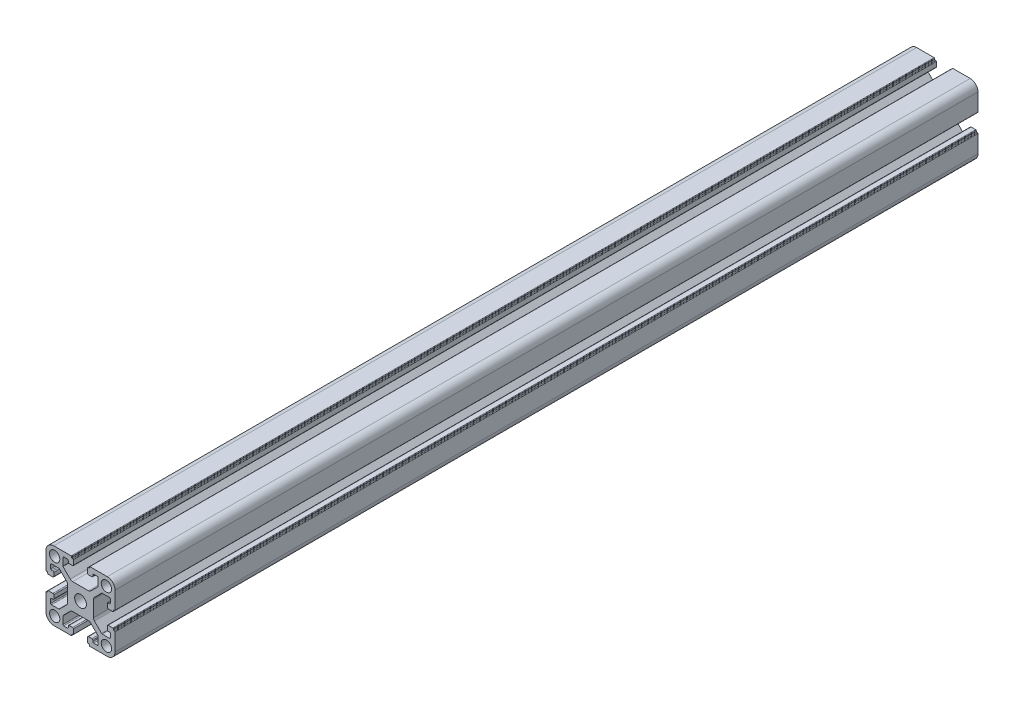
SolidWorks part; units mm, degrees
ref_plane "前视基准面" through (0, 0, 0) normal (0, 0, 1) x (1, 0, 0)
ref_plane "上视基准面" through (0, 0, 0) normal (0, 1, 0) x (1, 0, 0)
ref_plane "右视基准面" through (0, 0, 0) normal (1, 0, 0) x (0, 0, -1)
sketch "Model" plane through (0, 0, 0) normal (0, 0, 1) x (1, 0, 0)
  line L0 (2122.4889, 1192.84) -> (2122.4889, 1192.44)
  line L1 (2122.7889, 1192.14) -> (2123.1889, 1192.14)
  line L2 (2123.4889, 1191.84) -> (2123.4889, 1181.74)
  line L3 (2118.9889, 1177.24) -> (2108.8889, 1177.24)
  line L4 (2108.5889, 1177.54) -> (2108.5889, 1177.94)
  line L5 (2108.2889, 1178.24) -> (2107.8889, 1178.24)
  line L6 (2107.5889, 1178.54) -> (2107.5889, 1181.24)
  line L7 (2108.0889, 1181.74) -> (2110.0889, 1181.74)
  line L8 (2110.5889, 1181.24) -> (2110.5889, 1180.44)
  line L9 (2111.0889, 1179.94) -> (2113.2389, 1179.94)
  line L10 (2113.7389, 1180.44) -> (2113.7389, 1184.6616)
  line L11 (2113.5925, 1185.0151) -> (2109.4534, 1189.1542)
  line L12 (2108.0392, 1189.74) -> (2098.9387, 1189.74)
  line L13 (2097.5245, 1189.1542) -> (2093.3854, 1185.0151)
  line L14 (2093.2389, 1184.6616) -> (2093.2389, 1180.44)
  line L15 (2093.7389, 1179.94) -> (2095.8889, 1179.94)
  line L16 (2096.3889, 1180.44) -> (2096.3889, 1181.24)
  line L17 (2096.8889, 1181.74) -> (2098.8889, 1181.74)
  line L18 (2099.3889, 1181.24) -> (2099.3889, 1178.54)
  line L19 (2099.0889, 1178.24) -> (2098.6889, 1178.24)
  line L20 (2098.3889, 1177.94) -> (2098.3889, 1177.54)
  line L21 (2098.0889, 1177.24) -> (2087.9889, 1177.24)
  line L22 (2083.4889, 1181.74) -> (2083.4889, 1191.84)
  line L23 (2083.7889, 1192.14) -> (2084.1889, 1192.14)
  line L24 (2084.4889, 1192.44) -> (2084.4889, 1192.84)
  line L25 (2084.7889, 1193.14) -> (2087.4889, 1193.14)
  line L26 (2087.9889, 1192.64) -> (2087.9889, 1190.64)
  line L27 (2087.4889, 1190.14) -> (2086.6889, 1190.14)
  line L28 (2086.1889, 1189.64) -> (2086.1889, 1187.49)
  line L29 (2086.6889, 1186.99) -> (2090.9105, 1186.99)
  line L30 (2091.2641, 1187.1365) -> (2095.4031, 1191.2756)
  line L31 (2095.9889, 1192.6898) -> (2095.9889, 1201.7903)
  line L32 (2095.4031, 1203.2045) -> (2091.2641, 1207.3436)
  line L33 (2090.9105, 1207.49) -> (2086.6889, 1207.49)
  line L34 (2086.1889, 1206.99) -> (2086.1889, 1204.84)
  line L35 (2086.6889, 1204.34) -> (2087.4889, 1204.34)
  line L36 (2087.9889, 1203.84) -> (2087.9889, 1201.84)
  line L37 (2087.4889, 1201.34) -> (2084.7889, 1201.34)
  line L38 (2084.4889, 1201.64) -> (2084.4889, 1202.04)
  line L39 (2084.1889, 1202.34) -> (2083.7889, 1202.34)
  line L40 (2083.4889, 1202.64) -> (2083.4889, 1212.74)
  line L41 (2087.9889, 1217.24) -> (2098.0889, 1217.24)
  line L42 (2098.3889, 1216.94) -> (2098.3889, 1216.54)
  line L43 (2098.6889, 1216.24) -> (2099.0889, 1216.24)
  line L44 (2099.3889, 1215.94) -> (2099.3889, 1213.24)
  line L45 (2098.8889, 1212.74) -> (2096.8889, 1212.74)
  line L46 (2096.3889, 1213.24) -> (2096.3889, 1214.04)
  line L47 (2095.8889, 1214.54) -> (2093.7389, 1214.54)
  line L48 (2093.2389, 1214.04) -> (2093.2389, 1209.8184)
  line L49 (2093.3854, 1209.4649) -> (2097.5245, 1205.3258)
  line L50 (2098.9387, 1204.74) -> (2108.0392, 1204.74)
  line L51 (2109.4534, 1205.3258) -> (2113.5925, 1209.4649)
  line L52 (2113.7389, 1209.8184) -> (2113.7389, 1214.04)
  line L53 (2113.2389, 1214.54) -> (2111.0889, 1214.54)
  line L54 (2110.5889, 1214.04) -> (2110.5889, 1213.24)
  line L55 (2110.0889, 1212.74) -> (2108.0889, 1212.74)
  line L56 (2107.5889, 1213.24) -> (2107.5889, 1215.94)
  line L57 (2107.8889, 1216.24) -> (2108.2889, 1216.24)
  line L58 (2108.5889, 1216.54) -> (2108.5889, 1216.94)
  line L59 (2108.8889, 1217.24) -> (2118.9889, 1217.24)
  line L60 (2123.4889, 1212.74) -> (2123.4889, 1202.64)
  line L61 (2123.1889, 1202.34) -> (2122.7889, 1202.34)
  line L62 (2122.4889, 1202.04) -> (2122.4889, 1201.64)
  line L63 (2122.1889, 1201.34) -> (2119.4889, 1201.34)
  line L64 (2118.9889, 1201.84) -> (2118.9889, 1203.84)
  line L65 (2119.4889, 1204.34) -> (2120.2889, 1204.34)
  line L66 (2120.7889, 1204.84) -> (2120.7889, 1206.99)
  line L67 (2120.2889, 1207.49) -> (2116.0674, 1207.49)
  line L68 (2115.7138, 1207.3436) -> (2111.5747, 1203.2045)
  line L69 (2110.9889, 1201.7903) -> (2110.9889, 1192.6898)
  line L70 (2111.5747, 1191.2756) -> (2115.7138, 1187.1365)
  line L71 (2116.0674, 1186.99) -> (2120.2889, 1186.99)
  line L72 (2120.7889, 1187.49) -> (2120.7889, 1189.64)
  line L73 (2120.2889, 1190.14) -> (2119.4889, 1190.14)
  line L74 (2118.9889, 1190.64) -> (2118.9889, 1192.64)
  line L75 (2119.4889, 1193.14) -> (2122.1889, 1193.14)
  circle A1 centre (2103.4889, 1197.24) radius 3.4
  circle A2 centre (2118.4889, 1212.24) radius 3
  circle A3 centre (2088.4889, 1212.24) radius 3
  circle A4 centre (2088.4889, 1182.24) radius 3
  circle A5 centre (2118.4889, 1182.24) radius 3
  arc A6 (2122.4889, 1192.44) -> (2122.7889, 1192.14) centre (2122.7889, 1192.44) ccw
  arc A7 (2123.4889, 1191.84) -> (2123.1889, 1192.14) centre (2123.1889, 1191.84) ccw
  arc A8 (2118.9889, 1177.24) -> (2123.4889, 1181.74) centre (2118.9889, 1181.74) ccw
  arc A9 (2108.5889, 1177.54) -> (2108.8889, 1177.24) centre (2108.8889, 1177.54) ccw
  arc A10 (2108.5889, 1177.94) -> (2108.2889, 1178.24) centre (2108.2889, 1177.94) ccw
  arc A11 (2107.5889, 1178.54) -> (2107.8889, 1178.24) centre (2107.8889, 1178.54) ccw
  arc A12 (2108.0889, 1181.74) -> (2107.5889, 1181.24) centre (2108.0889, 1181.24) ccw
  arc A13 (2110.5889, 1181.24) -> (2110.0889, 1181.74) centre (2110.0889, 1181.24) ccw
  arc A14 (2110.5889, 1180.44) -> (2111.0889, 1179.94) centre (2111.0889, 1180.44) ccw
  arc A15 (2113.2389, 1179.94) -> (2113.7389, 1180.44) centre (2113.2389, 1180.44) ccw
  arc A16 (2113.7389, 1184.6616) -> (2113.5925, 1185.0151) centre (2113.2389, 1184.6616) ccw
  arc A17 (2109.4534, 1189.1542) -> (2108.0392, 1189.74) centre (2108.0392, 1187.74) ccw
  arc A18 (2098.9387, 1189.74) -> (2097.5245, 1189.1542) centre (2098.9387, 1187.74) ccw
  arc A19 (2093.3854, 1185.0151) -> (2093.2389, 1184.6616) centre (2093.7389, 1184.6616) ccw
  arc A20 (2093.2389, 1180.44) -> (2093.7389, 1179.94) centre (2093.7389, 1180.44) ccw
  arc A21 (2095.8889, 1179.94) -> (2096.3889, 1180.44) centre (2095.8889, 1180.44) ccw
  arc A22 (2096.8889, 1181.74) -> (2096.3889, 1181.24) centre (2096.8889, 1181.24) ccw
  arc A23 (2099.3889, 1181.24) -> (2098.8889, 1181.74) centre (2098.8889, 1181.24) ccw
  arc A24 (2099.0889, 1178.24) -> (2099.3889, 1178.54) centre (2099.0889, 1178.54) ccw
  arc A25 (2098.6889, 1178.24) -> (2098.3889, 1177.94) centre (2098.6889, 1177.94) ccw
  arc A26 (2098.0889, 1177.24) -> (2098.3889, 1177.54) centre (2098.0889, 1177.54) ccw
  arc A27 (2083.4889, 1181.74) -> (2087.9889, 1177.24) centre (2087.9889, 1181.74) ccw
  arc A28 (2083.7889, 1192.14) -> (2083.4889, 1191.84) centre (2083.7889, 1191.84) ccw
  arc A29 (2084.1889, 1192.14) -> (2084.4889, 1192.44) centre (2084.1889, 1192.44) ccw
  arc A30 (2084.7889, 1193.14) -> (2084.4889, 1192.84) centre (2084.7889, 1192.84) ccw
  arc A31 (2087.9889, 1192.64) -> (2087.4889, 1193.14) centre (2087.4889, 1192.64) ccw
  arc A32 (2087.4889, 1190.14) -> (2087.9889, 1190.64) centre (2087.4889, 1190.64) ccw
  arc A33 (2086.6889, 1190.14) -> (2086.1889, 1189.64) centre (2086.6889, 1189.64) ccw
  arc A34 (2086.1889, 1187.49) -> (2086.6889, 1186.99) centre (2086.6889, 1187.49) ccw
  arc A35 (2090.9105, 1186.99) -> (2091.2641, 1187.1365) centre (2090.9105, 1187.49) ccw
  arc A36 (2095.4031, 1191.2756) -> (2095.9889, 1192.6898) centre (2093.9889, 1192.6898) ccw
  arc A37 (2095.9889, 1201.7903) -> (2095.4031, 1203.2045) centre (2093.9889, 1201.7903) ccw
  arc A38 (2091.2641, 1207.3436) -> (2090.9105, 1207.49) centre (2090.9105, 1206.99) ccw
  arc A39 (2086.6889, 1207.49) -> (2086.1889, 1206.99) centre (2086.6889, 1206.99) ccw
  arc A40 (2086.1889, 1204.84) -> (2086.6889, 1204.34) centre (2086.6889, 1204.84) ccw
  arc A41 (2087.9889, 1203.84) -> (2087.4889, 1204.34) centre (2087.4889, 1203.84) ccw
  arc A42 (2087.4889, 1201.34) -> (2087.9889, 1201.84) centre (2087.4889, 1201.84) ccw
  arc A43 (2084.4889, 1201.64) -> (2084.7889, 1201.34) centre (2084.7889, 1201.64) ccw
  arc A44 (2084.4889, 1202.04) -> (2084.1889, 1202.34) centre (2084.1889, 1202.04) ccw
  arc A45 (2083.4889, 1202.64) -> (2083.7889, 1202.34) centre (2083.7889, 1202.64) ccw
  arc A46 (2087.9889, 1217.24) -> (2083.4889, 1212.74) centre (2087.9889, 1212.74) ccw
  arc A47 (2098.3889, 1216.94) -> (2098.0889, 1217.24) centre (2098.0889, 1216.94) ccw
  arc A48 (2098.3889, 1216.54) -> (2098.6889, 1216.24) centre (2098.6889, 1216.54) ccw
  arc A49 (2099.3889, 1215.94) -> (2099.0889, 1216.24) centre (2099.0889, 1215.94) ccw
  arc A50 (2098.8889, 1212.74) -> (2099.3889, 1213.24) centre (2098.8889, 1213.24) ccw
  arc A51 (2096.3889, 1213.24) -> (2096.8889, 1212.74) centre (2096.8889, 1213.24) ccw
  arc A52 (2096.3889, 1214.04) -> (2095.8889, 1214.54) centre (2095.8889, 1214.04) ccw
  arc A53 (2093.7389, 1214.54) -> (2093.2389, 1214.04) centre (2093.7389, 1214.04) ccw
  arc A54 (2093.2389, 1209.8184) -> (2093.3854, 1209.4649) centre (2093.7389, 1209.8184) ccw
  arc A55 (2097.5245, 1205.3258) -> (2098.9387, 1204.74) centre (2098.9387, 1206.74) ccw
  arc A56 (2108.0392, 1204.74) -> (2109.4534, 1205.3258) centre (2108.0392, 1206.74) ccw
  arc A57 (2113.5925, 1209.4649) -> (2113.7389, 1209.8184) centre (2113.2389, 1209.8184) ccw
  arc A58 (2113.7389, 1214.04) -> (2113.2389, 1214.54) centre (2113.2389, 1214.04) ccw
  arc A59 (2111.0889, 1214.54) -> (2110.5889, 1214.04) centre (2111.0889, 1214.04) ccw
  arc A60 (2110.0889, 1212.74) -> (2110.5889, 1213.24) centre (2110.0889, 1213.24) ccw
  arc A61 (2107.5889, 1213.24) -> (2108.0889, 1212.74) centre (2108.0889, 1213.24) ccw
  arc A62 (2107.8889, 1216.24) -> (2107.5889, 1215.94) centre (2107.8889, 1215.94) ccw
  arc A63 (2108.2889, 1216.24) -> (2108.5889, 1216.54) centre (2108.2889, 1216.54) ccw
  arc A64 (2108.8889, 1217.24) -> (2108.5889, 1216.94) centre (2108.8889, 1216.94) ccw
  arc A65 (2123.4889, 1212.74) -> (2118.9889, 1217.24) centre (2118.9889, 1212.74) ccw
  arc A66 (2123.1889, 1202.34) -> (2123.4889, 1202.64) centre (2123.1889, 1202.64) ccw
  arc A67 (2122.7889, 1202.34) -> (2122.4889, 1202.04) centre (2122.7889, 1202.04) ccw
  arc A68 (2122.1889, 1201.34) -> (2122.4889, 1201.64) centre (2122.1889, 1201.64) ccw
  arc A69 (2118.9889, 1201.84) -> (2119.4889, 1201.34) centre (2119.4889, 1201.84) ccw
  arc A70 (2119.4889, 1204.34) -> (2118.9889, 1203.84) centre (2119.4889, 1203.84) ccw
  arc A71 (2120.2889, 1204.34) -> (2120.7889, 1204.84) centre (2120.2889, 1204.84) ccw
  arc A72 (2120.7889, 1206.99) -> (2120.2889, 1207.49) centre (2120.2889, 1206.99) ccw
  arc A73 (2116.0674, 1207.49) -> (2115.7138, 1207.3436) centre (2116.0674, 1206.99) ccw
  arc A74 (2111.5747, 1203.2045) -> (2110.9889, 1201.7903) centre (2112.9889, 1201.7903) ccw
  arc A75 (2110.9889, 1192.6898) -> (2111.5747, 1191.2756) centre (2112.9889, 1192.6898) ccw
  arc A76 (2115.7138, 1187.1365) -> (2116.0674, 1186.99) centre (2116.0674, 1187.49) ccw
  arc A77 (2120.2889, 1186.99) -> (2120.7889, 1187.49) centre (2120.2889, 1187.49) ccw
  arc A78 (2120.7889, 1189.64) -> (2120.2889, 1190.14) centre (2120.2889, 1189.64) ccw
  arc A79 (2118.9889, 1190.64) -> (2119.4889, 1190.14) centre (2119.4889, 1190.64) ccw
  arc A80 (2119.4889, 1193.14) -> (2118.9889, 1192.64) centre (2119.4889, 1192.64) ccw
  arc A81 (2122.4889, 1192.84) -> (2122.1889, 1193.14) centre (2122.1889, 1192.84) ccw
extrude "凸台-拉伸1" add sketch "Model" along normal blind 500
